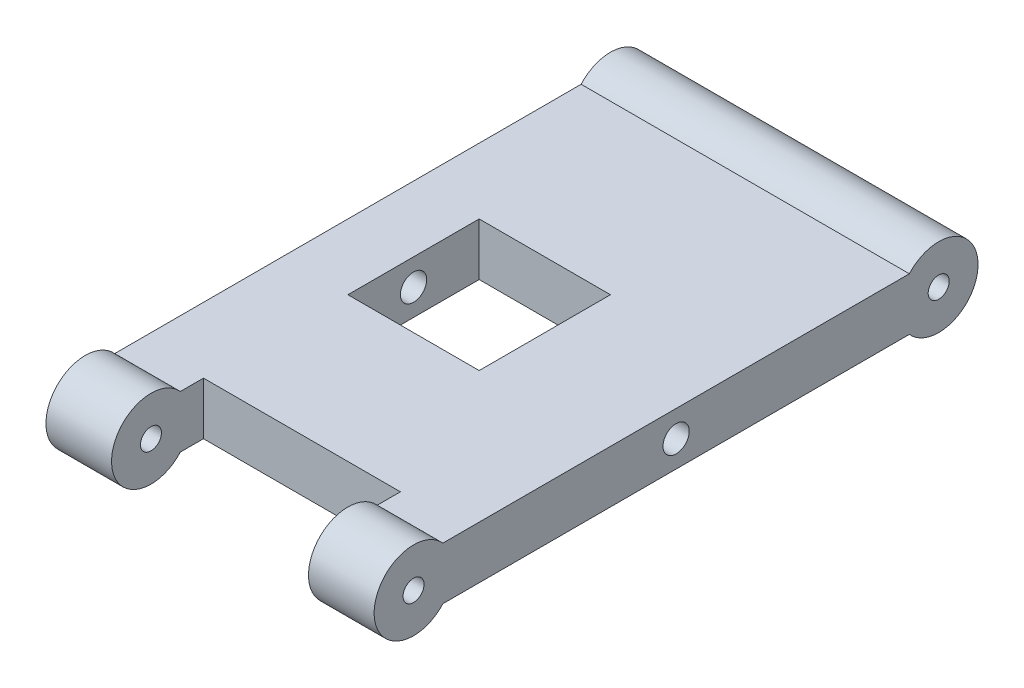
SolidWorks part; units mm, degrees
ref_plane "Front Plane" through (0, 0, 0) normal (0, 0, 1) x (1, 0, 0)
ref_plane "Top Plane" through (0, 0, 0) normal (0, 1, 0) x (1, 0, 0)
ref_plane "Right Plane" through (0, 0, 0) normal (1, 0, 0) x (0, 0, -1)
sketch "Sketch1" plane through (0, 0, 0) normal (1, 0, 0) x (0, 0, -1)
  line L1 (0, 0) -> (50.8, 0)
  line L2 (0, 0) -> (0, 5.08)
  line L3 (0, 5.08) -> (50.8, 5.08)
  line L4 (50.8, 0) -> (50.8, 5.08)
  dimension "D1" = 5.08
  dimension "D2" = 50.8
extrude "Boss-Extrude1" add sketch "Sketch1" along normal blind 31.75
sketch "Sketch2" plane through (31.75, 0, 0) normal (1, 0, 0) x (0, 0, -1)
  line L0 (0, 5.08) -> (0, 0) construction
  line L1 (50.8, 0) -> (50.8, 5.08) construction
  circle A0 centre (0, 2.54) radius 3.81
  circle A1 centre (50.8, 2.54) radius 3.81
  dimension "D1" = 7.62
  dimension "D2" = 7.62
extrude "Boss-Extrude2" add sketch "Sketch2" against normal blind 31.75
sketch "Sketch3" plane through (0, 5.08, 0) normal (0, 1, 0) x (1, 0, 0)
  line L0 (0, 47.9602) -> (0, 2.8398) construction
  line L1 (6.35, 5.08) -> (25.4, 5.08)
  line L2 (6.35, 5.08) -> (6.35, -8.6313)
  line L3 (6.35, -8.6313) -> (25.4, -8.6313)
  line L4 (25.4, 5.08) -> (25.4, -8.6313)
  line L5 (0, -3.81) -> (31.75, -3.81) construction
  dimension "D1" = 19.05
  dimension "D2" = 6.35
  dimension "D3" = 8.89
extrude "Cut-Extrude1" cut sketch "Sketch3" against normal mid plane 31.75
sketch "Sketch4" plane through (0, 5.08, 0) normal (0, 1, 0) x (1, 0, 0)
  line L0 (-3.3841, 25.4) -> (39.1226, 25.4) construction
  line L1 (0, 47.9602) -> (0, 2.8398) construction
  line L2 (6.35, 31.75) -> (19.05, 31.75)
  line L3 (6.35, 31.75) -> (6.35, 19.05)
  line L4 (6.35, 19.05) -> (19.05, 19.05)
  line L5 (19.05, 31.75) -> (19.05, 19.05)
  dimension "D1" = 25.4
  dimension "D2" = 6.35
  dimension "D3" = 12.7
  dimension "D4" = 12.7
  dimension "D5" = 6.35
extrude "Cut-Extrude2" cut sketch "Sketch4" against normal through all contours L3 L2 L5 L4
sketch "Sketch5" plane through (0, 0, 0) normal (-1, 0, 0) x (0, 0, 1)
  line L0 (-47.9602, 5.08) -> (-2.8398, 5.08) construction
  circle A0 centre (-25.4, 2.54) radius 1.27
  dimension "D1" = 2.54
  dimension "D2" = 2.54
extrude "Cut-Extrude3" cut sketch "Sketch5" against normal through all
sketch "Sketch6" plane through (0, 0, 0) normal (-1, 0, 0) x (0, 0, 1)
  circle A0 centre (-50.8, 2.54) radius 1.016
  circle A1 centre (0, 2.54) radius 1.016
  dimension "D1" = 2.032
extrude "Cut-Extrude4" cut sketch "Sketch6" against normal through all
